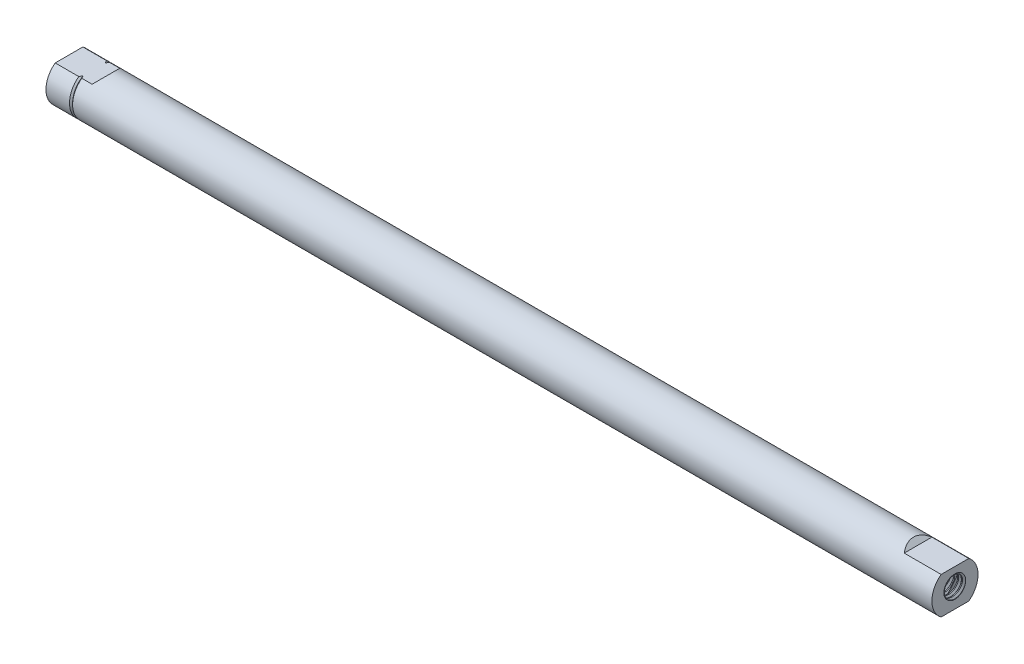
SolidWorks part; units mm, degrees
ref_plane "Front Plane" through (0, 0, 0) normal (0, 0, 1) x (1, 0, 0)
ref_plane "Top Plane" through (0, 0, 0) normal (0, 1, 0) x (1, 0, 0)
ref_plane "Right Plane" through (0, 0, 0) normal (1, 0, 0) x (0, 0, -1)
sketch "Sketch1" plane through (0, 0, 0) normal (1, 0, 0) x (0, 0, -1)
  circle A0 centre (0, 0) radius 7.5
  dimension "D1" = 15
extrude "Boss-Extrude1" add sketch "Sketch1" along normal mid plane 288
sketch "Sketch2" plane through (144, 0, 0) normal (1, 0, 0) x (0, 0, -1)
  circle A0 centre (0, 0) radius 3.25
  dimension "D1" = 6.5
extrude "Cut-Extrude1" cut sketch "Sketch2" against normal blind 50
thread "Thread1" pitch 1.25 start angle 0, offset 2, length 50, pitch 1.25, diameter 6.5
ref_plane "Plane1" through (146, 0, 3.25) normal (0, -1, 0) x (0, 0, 1)
sketch "Thread Profile1" plane through (146, 0, 3.25) normal (0, -1, 0) x (0, 0, 1)
  line L0 (0, 0) -> (0, 1.25) construction
  line L1 (0, 0) -> (0.6766, 0.3906)
  line L2 (0.6766, 0.3906) -> (0.6766, 0.5469)
  line L3 (0.6766, 0.5469) -> (0, 0.9375)
  line L4 (0.6766, 0.4687) -> (0, 0.4687) construction
  line L11 (0, 0) -> (0, 0.9375)
  point P2 (0, 0)
  dimension "Pitch" = 1.25
  dimension "Profile_Angle" = 60
  dimension "Profile_Land" = 0.1562
  dimension "Profile_Height" = 0.6766
sketch "Sketch6" plane through (0, 0, 0) normal (0, 0, 1) x (1, 0, 0)
  line L0 (144, -7.5) -> (144, 7.5) construction
  line L1 (144, -7.5) -> (144, 7.5) construction
  line L2 (144, 6) -> (132, 6)
  line L3 (132, 6) -> (130.5, 7.5)
  line L4 (144, 7.5) -> (-144, 7.5) construction
  line L5 (130.5, 7.5) -> (144, 7.5)
  line L6 (144, 7.5) -> (144, 6)
  dimension "D1" = 135
  dimension "D2" = 1.5
  dimension "D3" = 12
extrude "Cut-Extrude2" cut sketch "Sketch6" against normal through all both and the other way through all
mirror "Mirror1" about plane through (0, 0, 0) normal (0, 1, 0) of "Cut-Extrude2"
chamfer "Chamfer1" [suppressed] distance 0.5 angle 45
mirror "Mirror2" about plane through (0, 0, 0) normal (1, 0, 0) of "Mirror1", "Cut-Extrude2", "Cut-Extrude1"
thread "Thread2" start angle 0, offset 2, length 50, pitch 1.25, diameter 6.5
ref_plane "Plane2" through (-146, 0, -3.25) normal (0, -1, 0) x (0, 0, -1)
sketch "Thread Profile2" plane through (-146, 0, -3.25) normal (0, -1, 0) x (0, 0, -1)
  line L0 (0, 0) -> (0, 1.25) construction
  line L1 (0, 0) -> (0.6766, 0.3906)
  line L2 (0.6766, 0.3906) -> (0.6766, 0.5469)
  line L3 (0.6766, 0.5469) -> (0, 0.9375)
  line L4 (0.6766, 0.4687) -> (0, 0.4687) construction
  line L11 (0, 0) -> (0, 0.9375)
  point P2 (0, 0)
  dimension "Pitch" = 1.25
  dimension "Profile_Angle" = 60
  dimension "Profile_Land" = 0.1562
  dimension "Profile_Height" = 0.6766
sketch "Sketch11" plane through (0, 0, 0) normal (0, 0, 1) x (1, 0, 0)
  line L0 (-136.3454, 7.5) -> (-135.8454, 7)
  line L1 (-135.8454, 7) -> (-135.3454, 7.5)
  line L2 (130.5, 7.5) -> (-130.5, 7.5) construction
  line L3 (-135.3454, 7.5) -> (-136.3454, 7.5)
  line L4 (-144, 6) -> (-144, -6) construction
  line L5 (-144, 6) -> (-144, -6) construction
  line L6 (-144, 0) -> (-122.7316, 0) construction
  dimension "D1" = 0.5
  dimension "D2" = 1
revolve "Cut-Revolve1" cut sketch "Sketch11" angle 360 about L6
